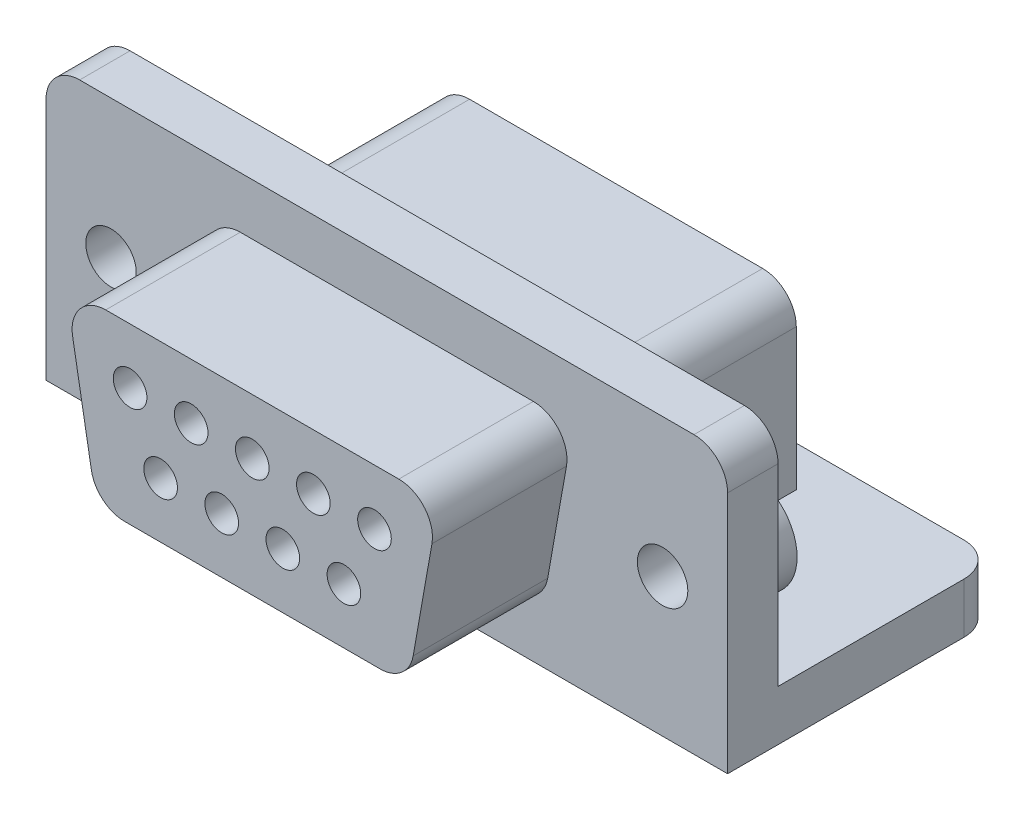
SolidWorks part; units mm, degrees
ref_plane "Plane1" through (0, 0, 0) normal (0, 0, 1) x (1, 0, 0)
ref_plane "Plane2" through (0, 0, 0) normal (0, 1, 0) x (1, 0, 0)
ref_plane "Plane3" through (0, 0, 0) normal (1, 0, 0) x (0, 0, -1)
sketch "Sketch1" plane through (0, 0, 0) normal (0, 0, 1) x (1, 0, 0)
  line L0 (0, 0) -> (30.8864, 0)
  line L1 (0, 0) -> (0, 12.5476)
  line L2 (30.8864, 12.5476) -> (0, 12.5476)
  line L3 (30.8864, 12.5476) -> (30.8864, 0)
  dimension "D1" = 30.8864
  dimension "D2" = 12.5476
extrude "Base-Extrude" add sketch "Sketch1" along normal blind 2.286
fillet "Fillet1" radius 1.524 2 edges at (30.8864, 12.5476, 1.143) (0, 12.5476, 1.143)
sketch "Sketch2" plane through (0, 0, 2.286) normal (0, 0, 1) x (1, 0, 0)
  line L0 (9.6543, 2.3368) -> (21.2321, 2.3368)
  line L1 (22.7329, 3.5962) -> (23.5839, 8.4222)
  line L2 (22.0831, 10.2108) -> (8.8033, 10.2108)
  line L3 (7.3025, 8.4222) -> (8.1535, 3.5962)
  line L6 (29.3624, 12.5476) -> (1.524, 12.5476) construction
  arc A0 (7.3025, 8.4222) -> (8.8033, 10.2108) centre (8.8033, 8.6868) cw
  arc A1 (23.5839, 8.4222) -> (22.0831, 10.2108) centre (22.0831, 8.6868) ccw
  arc A2 (8.1535, 3.5962) -> (9.6543, 2.3368) centre (9.6543, 3.8608) ccw
  arc A3 (22.7329, 3.5962) -> (21.2321, 2.3368) centre (21.2321, 3.8608) cw
  point P4 (15.4432, 12.5476)
  point P9 (4.8299, 6.2738)
  dimension "D1" = 1.524
  dimension "D5" = 1.524
  dimension "D2" = 100
  dimension "D3" = 7.874
  dimension "D4" = 80
  dimension "D6" = 3.937
  dimension "D7" = 16.2814
  dimension "D8" = 8.1407
extrude "Boss-Extrude1" add sketch "Sketch2" along normal blind 6.096
sketch "Sketch3" plane through (0, 0, 2.286) normal (0, 0, 1) x (1, 0, 0)
  line L0 (0, 0) -> (30.8864, 0) construction
  circle A0 centre (27.94, 6.2738) radius 1.143
  circle A1 centre (2.9464, 6.2738) radius 1.143
  point P8 (15.4432, 0)
  dimension "D1" = 24.9936
  dimension "D2" = 6.2738
  dimension "D3" = 2.286
  dimension "D4" = 12.4968
extrude "Cut-Extrude1" cut sketch "Sketch3" against normal through all
sketch "Sketch4" plane through (0, 0, 0) normal (0, 0, -1) x (-1, 0, 0)
  line L0 (0, 0) -> (-30.8864, 0) construction
  line L1 (0, 0) -> (-30.8864, 0)
  line L2 (0, 0) -> (0, 11.0236) construction
  line L3 (0, 0) -> (0, 2.286)
  line L4 (-30.8864, 11.0236) -> (-30.8864, 0) construction
  line L5 (-30.8864, 2.286) -> (-30.8864, 0)
  line L6 (-30.8864, 2.286) -> (0, 2.286)
  dimension "D1" = 2.286
extrude "Boss-Extrude2" add sketch "Sketch4" along normal blind 9.9568
fillet "Fillet2" radius 1.524 4 edges at (0, 1.143, -9.9568) (30.8864, 1.143, -9.9568)
sketch "Sketch5" plane through (0, 0, 0) normal (0, 0, -1) x (-1, 0, 0)
  circle A0 centre (-2.9464, 6.2738) radius 2.286
  circle A1 centre (-27.94, 6.2738) radius 2.286
  dimension "D1" = 4.572
extrude "Boss-Extrude3" add sketch "Sketch5" along normal blind 1.524
sketch "Sketch6" plane through (0, 0, -1.524) normal (0, 0, -1) x (-1, 0, 0)
  circle A0 centre (-27.94, 6.2738) radius 1.143 construction
  circle A1 centre (-2.9464, 6.2738) radius 1.143 construction
  circle A2 centre (-27.94, 6.2738) radius 1.143
  circle A3 centre (-2.9464, 6.2738) radius 1.143
extrude "Cut-Extrude2" cut sketch "Sketch6" against normal through all
sketch "Sketch7" plane through (0, 0, 0) normal (0, 0, -1) x (-1, 0, 0)
  line L1 (-22.0599, 10.2108) -> (-8.7802, 10.2108)
  line L2 (-7.2562, 8.6868) -> (-7.2562, 2.286)
  line L3 (-29.3624, 2.286) -> (-1.524, 2.286) construction
  line L4 (-23.5839, 8.6868) -> (-23.5839, 2.286)
  line L5 (-23.5839, 2.286) -> (-7.2562, 2.286)
  arc A2 (-7.2562, 8.6868) -> (-8.7802, 10.2108) centre (-8.7802, 8.6868) ccw
  arc A3 (-22.0599, 10.2108) -> (-23.5839, 8.6868) centre (-22.0599, 8.6868) ccw
extrude "Boss-Extrude4" add sketch "Sketch7" along normal blind 8.128
sketch "Sketch8" plane through (0, 0, 8.382) normal (0, 0, 1) x (1, 0, 0)
  circle A0 centre (9.906, 7.6962) radius 0.762
  circle A2 centre (2.9464, 6.2738) radius 1.143 construction
  circle A3 centre (11.2903, 4.8514) radius 0.762
  circle A4 centre (12.6746, 7.6962) radius 0.762
  circle A5 centre (14.0589, 4.8514) radius 0.762
  circle A6 centre (15.4432, 7.6962) radius 0.762
  circle A7 centre (16.8275, 4.8514) radius 0.762
  circle A8 centre (18.2118, 7.6962) radius 0.762
  circle A9 centre (19.5961, 4.8514) radius 0.762
  circle A10 centre (20.9804, 7.6962) radius 0.762
  point P23 (15.4432, 7.6962)
  dimension "D1" = 1.4224
  dimension "D2" = 2.8448
  dimension "D3" = 1.524
  dimension "D4" = 2.7686
  dimension "D5" = 1.3843
  dimension "D6" = 2.7686
  dimension "D7" = 2.7686
  dimension "D8" = 2.7686
  dimension "D9" = 2.7686
  dimension "D10" = 2.7686
  dimension "D11" = 2.7686
  dimension "D12" = 5.5372
extrude "Cut-Extrude3" cut sketch "Sketch8" against normal blind 6.35
sketch "Sketch9" plane through (0, 0, 0) normal (0, -1, 0) x (1, 0, 0)
  line L0 (0, 2.286) -> (30.8864, 2.286) construction
  circle A0 centre (2.9464, -7.239) radius 1.397
  circle A1 centre (27.94, -7.239) radius 1.397
  point P6 (15.4432, 2.286)
  dimension "D1" = 2.794
  dimension "D3" = 24.9936
  dimension "D2" = 9.525
  dimension "D4" = 12.4968
